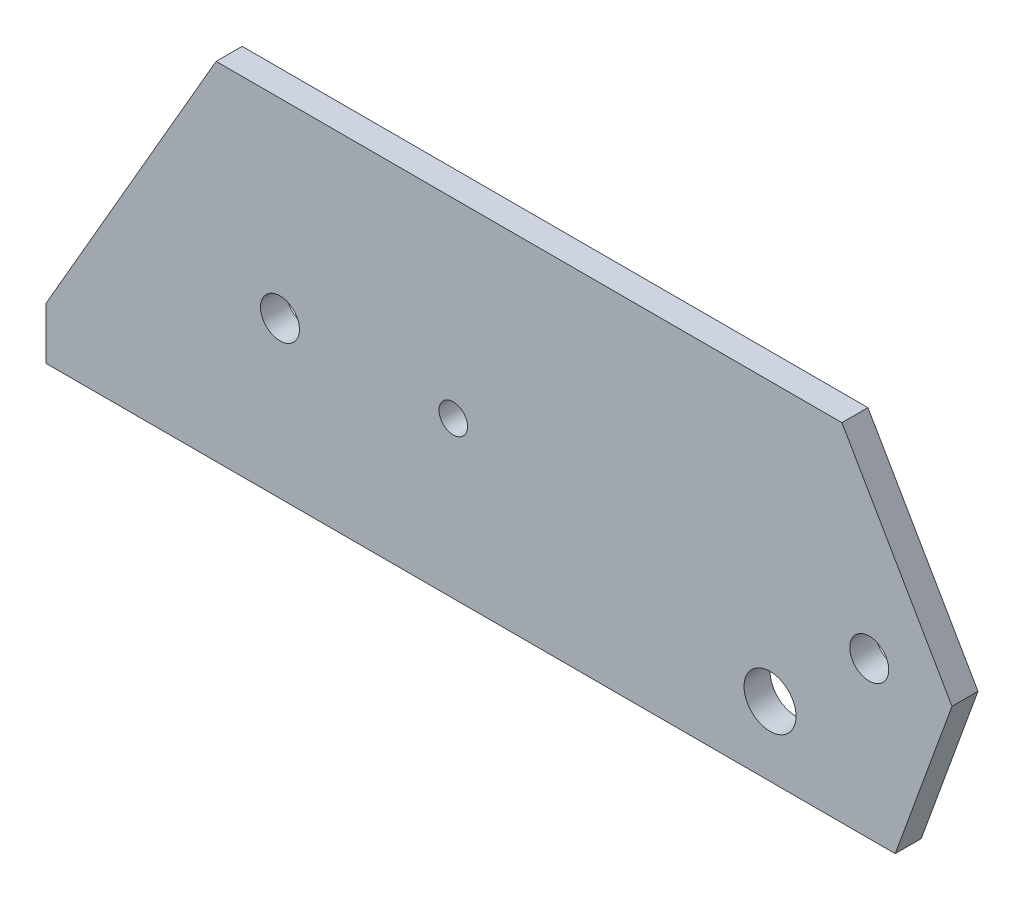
SolidWorks part; units mm, degrees
ref_plane "Front Plane" through (0, 0, 0) normal (0, 0, 1) x (1, 0, 0)
ref_plane "Top Plane" through (0, 0, 0) normal (0, 1, 0) x (1, 0, 0)
ref_plane "Right Plane" through (0, 0, 0) normal (1, 0, 0) x (0, 0, -1)
sketch "Sketch1" plane through (0, 0, 0) normal (0, 0, 1) x (1, 0, 0)
  line L0 (0, 0) -> (0, 6)
  line L1 (0, 6) -> (19.6299, 40)
  line L2 (19.6299, 40) -> (91.8498, 40)
  line L3 (91.8498, 40) -> (104.5515, 18)
  line L4 (104.5515, 18) -> (98, 0)
  line L5 (98, 0) -> (0, 0)
  circle A0 centre (27, 18) radius 2.25
  circle A1 centre (83.5515, 8) radius 3
  circle A2 centre (95, 18) radius 2.25
  dimension "D8" = 4.5
  dimension "D10" = 27
  dimension "D11" = 8
  dimension "D12" = 6
  dimension "D14" = 18
  dimension "D15" = 68
  dimension "D16" = 4.5
  dimension "D1" = 6
  dimension "D2" = 60
  dimension "D3" = 18
  dimension "D4" = 60
  dimension "D5" = 98
  dimension "D6" = 110
  dimension "D7" = 40
  dimension "D9" = 12
  dimension "D13" = 21
extrude "Extrude1" add sketch "Sketch1" along normal blind 3
sketch "Sketch2" plane through (0, 0, 3) normal (0, 0, 1) x (1, 0, 0)
  line L0 (0, 0) -> (98, 0) construction
  point P0 (47, 18)
  dimension "D1" = 47
  dimension "D2" = 18
hole_wizard "M4 Tapped Hole1" positions "3DSketch1" profile "Sketch4" tap size "M4" standard "ISO"
sketch3d "3DSketch1"
  point P0 (47, 18, 3)
sketch "Sketch4" plane through (47, 18, 3) normal (1, 0, 0) x (0, -1, 0)
  line L0 (0, 0) -> (0, 3)
  line L1 (0, 3) -> (1.65, 3)
  line L2 (1.65, 3) -> (1.65, 0)
  line L5 (1.65, 0) -> (0, 0)
  line L11 (0, -6.35) -> (0, 107.95) construction
  dimension "Thru Tap Drill Dia." = 3.3
  dimension "Thru Tap Drill Depth" = 3
